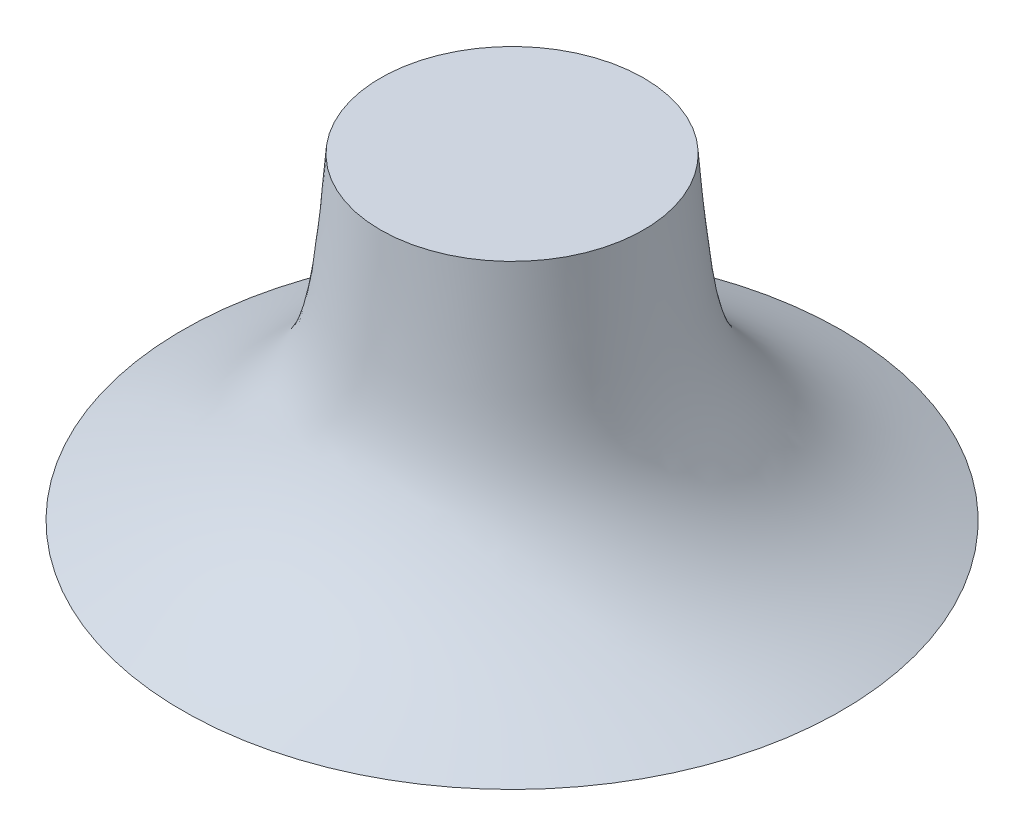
SolidWorks part; units mm, degrees
ref_plane "Front Plane" through (0, 0, 0) normal (0, 0, 1) x (1, 0, 0)
ref_plane "Top Plane" through (0, 0, 0) normal (0, 1, 0) x (1, 0, 0)
ref_plane "Right Plane" through (0, 0, 0) normal (1, 0, 0) x (0, 0, -1)
sketch "Sketch2" plane through (0, 0, 0) normal (0, 0, 1) x (1, 0, 0)
  line L0 (2.4217, -10.2214) -> (2.4217, 84.7786) construction
  line L1 (2.4217, 81.7786) -> (-34.21, 81.7786)
  line L2 (2.4217, 84.7786) -> (-36.9812, 84.7786)
  line L3 (2.4217, -10.2214) -> (-96.2375, -10.2214)
  line L4 (2.4217, -7.2214) -> (-82.7825, -7.2214)
  line L5 (2.4217, -10.2214) -> (2.4217, -7.2214)
  line L6 (2.4217, 84.7786) -> (2.4217, 81.7786)
  spline S0 degree 3 poles (-96.2375, -10.2214) (-94.7597, -9.551) (-83.2199, -4.3012) (-63.6138, 5.5538) (-43.3666, 28.9863) (-39.5987, 54.6948) (-37.9084, 73.1511) (-37.1763, 82.3063) (-36.9812, 84.7786) knots 0.066076 0.066076 0.066076 0.066076 0.101283 0.340833 0.539778 0.744207 0.890468 0.944398 0.944398 0.944398 0.944398
  spline S1 degree 3 poles (-34.21, 81.7786) (-34.5592, 77.4127) (-35.2882, 68.6973) (-36.6171, 55.5607) (-38.1693, 44.3108) (-40.4447, 35.4569) (-42.8594, 28.9764) (-46.167, 22.8289) (-51.5397, 15.2514) (-59.7419, 6.9166) (-70.9035, -0.9979) (-78.7708, -5.2267) (-82.7825, -7.2214) knots 0.162762 0.162762 0.162762 0.162762 0.257955 0.353148 0.448341 0.495938 0.543534 0.591131 0.638727 0.73392 0.829114 0.924307 0.924307 0.924307 0.924307
revolve "Revolve1" add sketch "Sketch2" angle 360 about L0
